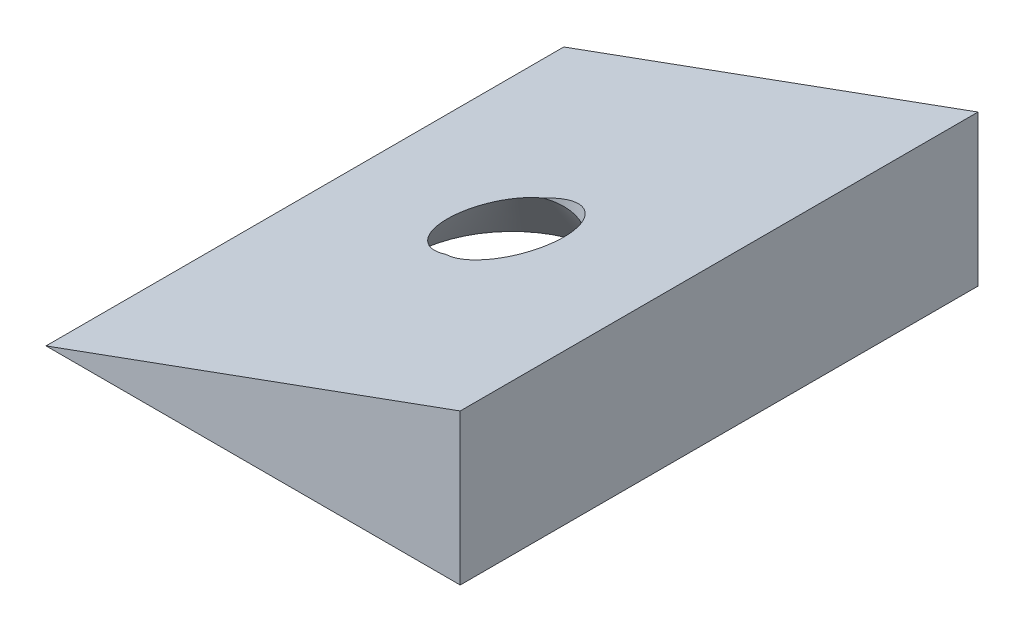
SolidWorks part; units mm, degrees
ref_plane "Front Plane" through (0, 0, 0) normal (0, 0, 1) x (1, 0, 0)
ref_plane "Top Plane" through (0, 0, 0) normal (0, 1, 0) x (1, 0, 0)
ref_plane "Right Plane" through (0, 0, 0) normal (1, 0, 0) x (0, 0, -1)
imported_body "Imported1"
scale "Scale1" scale about centroid uniform scaling yes scale factor 0.393701
